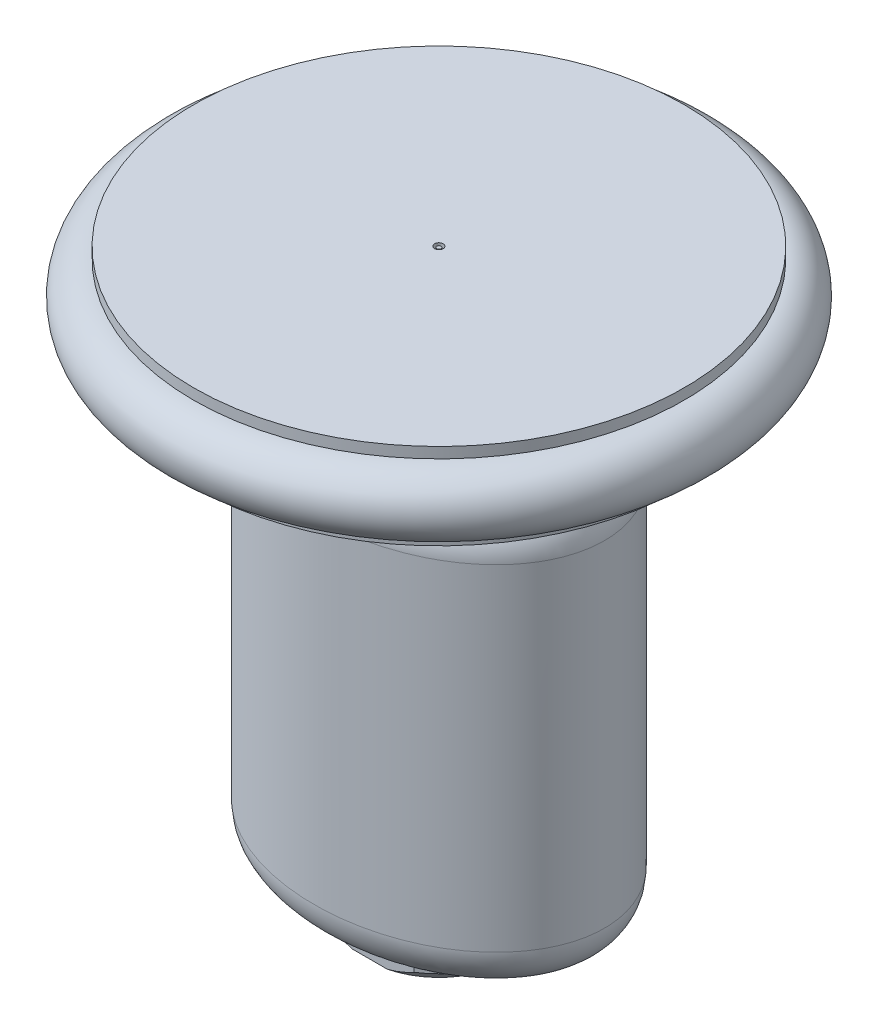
SolidWorks part; units mm, degrees
ref_plane "Front Plane" through (0, 0, 0) normal (0, 0, 1) x (1, 0, 0)
ref_plane "Top Plane" through (0, 0, 0) normal (0, 1, 0) x (1, 0, 0)
ref_plane "Right Plane" through (0, 0, 0) normal (1, 0, 0) x (0, 0, -1)
sketch "Sketch1" plane through (0, 0, 0) normal (0, 1, 0) x (1, 0, 0)
  circle A0 centre (0, 0) radius 7.366 construction
  ellipse E0 centre (0, 0) end of major axis (-9.779, 0) minor radius 7.366
  dimension "D1" = 14.732
  dimension "D2" = 19.558
extrude "Boss-Extrude1" add sketch "Sketch1" along normal blind 24.892
fillet "Fillet1" radius 2.54 2 edges at (-9.779, 0, 0) (-9.779, 24.892, 0)
sketch "Sketch2" plane through (0, 24.892, 0) normal (0, 1, 0) x (1, 0, 0)
  circle A0 centre (0, 0) radius 2.921
  dimension "D1" = 5.842
extrude "Boss-Extrude2" add sketch "Sketch2" along normal blind 1.27
sketch "Sketch3" plane through (0, 26.162, 0) normal (0, 1, 0) x (1, 0, 0)
  circle A0 centre (0, 0) radius 2.794
  dimension "D1" = 5.588
extrude "Cut-Extrude1" cut sketch "Sketch3" against normal blind 0.0635
sketch "Sketch4" plane through (0, 26.0985, 0) normal (0, 1, 0) x (1, 0, 0)
  circle A0 centre (0, 0) radius 0.127
  dimension "D1" = 0.254
extrude "Boss-Extrude3" add sketch "Sketch4" along normal blind 6.35
sketch "Sketch5" plane through (0, 0, 0) normal (0, -1, 0) x (1, 0, 0)
  line L0 (-2.6027, 4.064) -> (2.6027, 4.064)
  circle A0 centre (0, 0) radius 4.826
  dimension "D1" = 9.652
  dimension "D2" = 4.064
extrude "Boss-Extrude4" add sketch "Sketch5" along normal blind 1.905 contours L0 A0
chamfer "Chamfer1" distance 0.635 angle 45 1 edges at (0, -1.905, -4.826)
ref_plane "Wheel Height" through (0, 27.432, 0) normal (0, 1, 0) x (1, 0, 0)
sketch "Sketch6" plane through (0, 27.432, 0) normal (0, 1, 0) x (1, 0, 0)
  circle A0 centre (0, 0) radius 0.254
  circle A1 centre (0, 0) radius 14.478
  dimension "D1" = 0.508
  dimension "D2" = 28.956
extrude "Boss-Extrude5" add sketch "Sketch6" along normal blind 5.08 separate body
ref_axis "Axis1" through (0, 32.4485, 0) along (0, -1, 0)
sketch "Sketch7" plane through (0, 0, 0) normal (0, 0, 1) x (1, 0, 0)
  line L0 (14.478, 27.432) -> (14.478, 32.512) construction
  circle A0 centre (14.478, 29.972) radius 2.54 construction
  circle A1 centre (14.478, 29.972) radius 1.778
  dimension "D1" = 5.08
  dimension "D2" = 3.556
revolve "Cut-Revolve1" cut sketch "Sketch7" angle 360 about axis through (0, 32.4485, 0) along (0, -1, 0)
sketch "Sketch8" plane through (0, 0, 0) normal (0, 0, 1) x (1, 0, 0)
  circle A0 centre (14.478, 29.972) radius 1.905
  point P2 (18.2048, 29.9814)
  point P3 (14.478, 29.972)
  point P5 (12.7, 29.972)
  dimension "D1" = 3.81
revolve "Revolve1" add sketch "Sketch8" angle 360 about axis through (0, 32.4485, 0) along (0, -1, 0)
